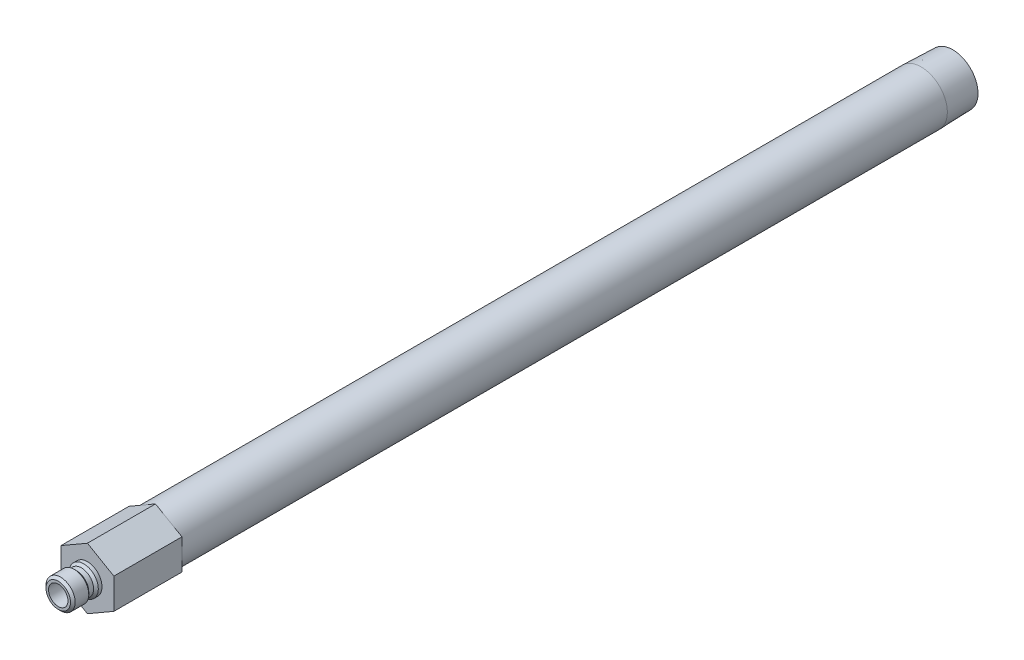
SolidWorks part; units mm, degrees
ref_plane "Front Plane" through (0, 0, 0) normal (0, 0, 1) x (1, 0, 0)
ref_plane "Top Plane" through (0, 0, 0) normal (0, 1, 0) x (1, 0, 0)
ref_plane "Right Plane" through (0, 0, 0) normal (1, 0, 0) x (0, 0, -1)
sketch "Sketch1" plane through (0, 0, 0) normal (1, 0, 0) x (0, 0, -1)
  line L0 (0, 0) -> (-12.7, 0) construction
  line L1 (-9.525, 3.175) -> (-9.525, 4.0005)
  line L2 (-3.556, 4.0005) -> (-3.556, 0) construction
  line L3 (-8.763, 4.7625) -> (-4.318, 4.7625)
  line L4 (0, 8.5725) -> (0, 0) construction
  line L5 (-3.556, 4.0005) -> (-1.9685, 4.0005)
  line L6 (-1.2065, 4.7625) -> (0, 4.7625)
  line L7 (0, 4.7625) -> (0, 8.5725)
  line L8 (-3.556, 4.0005) -> (-4.318, 4.7625)
  line L9 (-1.9685, 4.0005) -> (-1.2065, 4.7625)
  line L10 (-9.525, 4.0005) -> (-8.763, 4.7625)
  line L11 (-9.525, 3.175) -> (22.225, 3.175)
  line L12 (0, 8.5725) -> (272.2372, 8.5725)
  line L13 (272.2372, 8.5725) -> (282.575, 8.2494)
  line L14 (282.575, 8.2494) -> (282.575, 6.2611)
  line L15 (0, 0) -> (22.225, 0) construction
  line L16 (22.225, 0) -> (22.225, 3.175) construction
  line L17 (22.225, 4.7625) -> (0, 4.7625) construction
  line L18 (22.225, 3.175) -> (22.225, 6.2611)
  line L19 (22.225, 6.2611) -> (282.575, 6.2611)
  line L20 (22.225, 3.175) -> (22.225, 4.7625) construction
  dimension "D1" = 9.525
  dimension "D2" = 1.5875
  dimension "D3" = 0.762
  dimension "D4" = 45
  dimension "D5" = 5.969
  dimension "D6" = 45
  dimension "D7" = 1.79
  dimension "D8" = 10.3378
  dimension "D9" = 292.1
  dimension "D10" = 3.175
  dimension "D11" = 31.75
  dimension "D12" = 6.35
  dimension "D13" = 12.5222
  dimension "D14" = 9.525
  dimension "D15" = 17.145
revolve "Revolve1" add sketch "Sketch1" angle 360 about L0
sketch "Sketch2" plane through (0, 0, 0) normal (0, 0, 1) x (1, 0, 0)
  line L1 (-8.636, 4.986) -> (-8.636, -4.986)
  line L2 (-8.636, -4.986) -> (0, -9.972)
  line L3 (0, -9.972) -> (8.636, -4.986)
  line L4 (8.636, -4.986) -> (8.636, 4.986)
  line L5 (8.636, 4.986) -> (0, 9.972)
  line L6 (0, 9.972) -> (-8.636, 4.986)
  circle A0 centre (0, 0) radius 8.636 construction
  circle A1 centre (0, 0) radius 3.175 construction
  circle A2 centre (0, 0) radius 3.175
  dimension "D1" = 17.272
extrude "Boss-Extrude1" add sketch "Sketch2" against normal up to vertex (22.225 mm away) from vertex at 0
